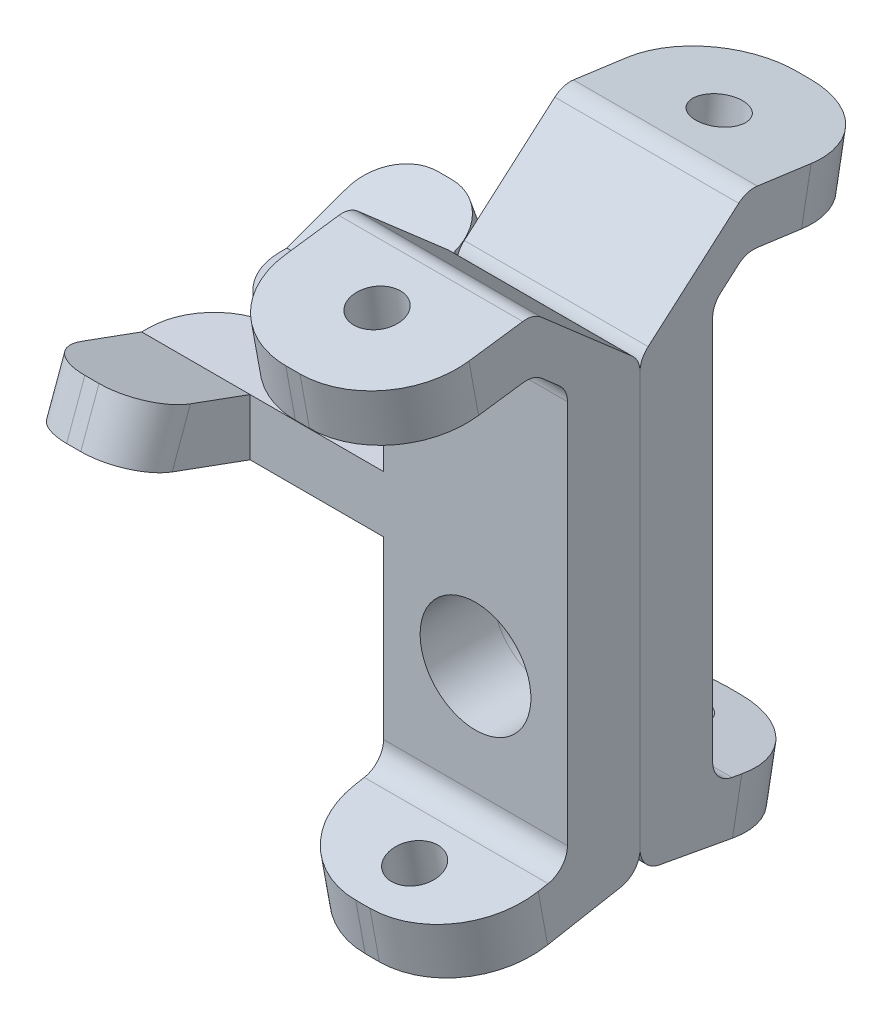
SolidWorks part; units mm, degrees
other "<spindle2>-<Cut-Extrude2>"
ref_plane "Front Plane" through (0, 0, 0) normal (0, 0, 1) x (1, 0, 0)
ref_plane "Top Plane" through (0, 0, 0) normal (0, 1, 0) x (1, 0, 0)
ref_plane "Right Plane" through (0, 0, 0) normal (1, 0, 0) x (0, 0, -1)
inserted part "spindle2"
mirror "Mirror1" about plane through (0, 0, 0) normal (0, 0, 1)
ref_point "Point1"
sketch3d "3DSketch1"
  line L0 (0, 96.8465, -46.084) -> (-0.4245, 122.2003, -46.084)
sketch3d "3DSketch2"
  line L0 (0, -51.5502, -33.4254) -> (0, -76.963, -33.4254)
  line L1 (0, -51.5502, -33.4254) -> (0, -37.7898, -35.951) construction
sketch3d "3DSketch3"
  line L0 (0, 0, 0) -> (0, 0, 76.2)
  dimension "D1" = 76.2
